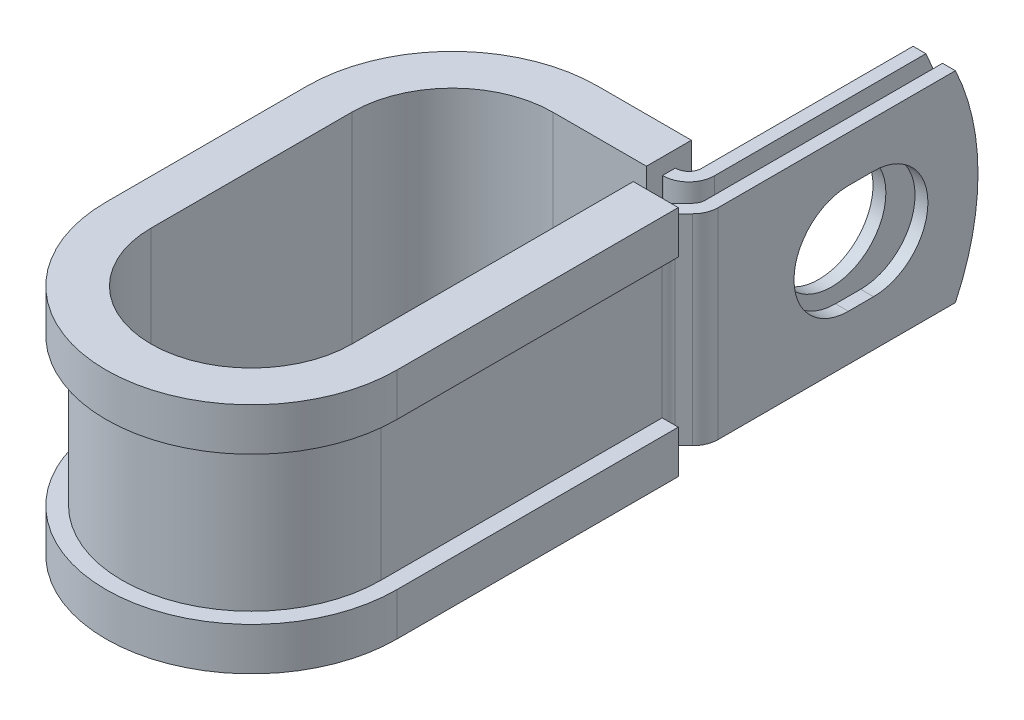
SolidWorks part; units mm, degrees
ref_plane "Front Plane" through (0, 0, 0) normal (0, 0, 1) x (1, 0, 0)
ref_plane "Top Plane" through (0, 0, 0) normal (0, 1, 0) x (1, 0, 0)
ref_plane "Right Plane" through (0, 0, 0) normal (1, 0, 0) x (0, 0, -1)
sketch "Sketch1" plane through (0, 0, 0) normal (0, 1, 0) x (1, 0, 0)
  line L0 (0, 11.049) -> (8.9333, 11.049)
  line L1 (11.049, 0) -> (11.049, 7.6365)
  line L2 (11.3717, 35.687) -> (11.3717, 13.4874)
  line L3 (11.7632, 9.3607) -> (12.5894, 10.1869)
  line L4 (-11.049, 0) -> (-11.049, -19.05)
  line L5 (12.9465, 11.049) -> (12.9465, 35.687)
  line L6 (11.049, 0) -> (11.049, -19.05)
  arc A0 (0, 11.049) -> (-11.049, 0) centre (0, 0) ccw
  arc A1 (11.7632, 9.3607) -> (11.049, 7.6365) centre (13.4874, 7.6365) ccw
  arc A2 (12.5894, 10.1869) -> (12.9465, 11.049) centre (11.7273, 11.049) ccw
  arc A3 (8.9333, 11.049) -> (11.3717, 13.4874) centre (8.9333, 13.4874) ccw
  arc A4 (-11.049, -19.05) -> (11.049, -19.05) centre (0, -19.05) ccw
extrude "Extrude-Thin1" add sketch "Sketch1" along normal mid plane 19.05 thin
sketch "Sketch2" plane through (10.1525, 0, 0) normal (-1, 0, 0) x (0, 0, 1)
  line L0 (-35.687, 9.525) -> (-35.687, -9.525) construction
  line L1 (0, 9.525) -> (0, -9.525) construction
  circle A0 centre (-24.5872, 0) radius 5.1562
  point P2 (-35.687, 0)
extrude "Cut-Extrude1" cut sketch "Sketch2" against normal up to surface (1.2192 mm away)
sketch "Sketch3" plane through (14.1657, 0, 0) normal (1, 0, 0) x (0, 0, -1)
  line L0 (23.3934, 0) -> (25.781, 0) construction
  line L1 (23.3934, 5.1562) -> (25.781, 5.1562)
  line L2 (23.3934, -5.1562) -> (25.781, -5.1562)
  line L3 (35.687, 9.525) -> (35.687, -9.525) construction
  arc A0 (23.3934, 5.1562) -> (23.3934, -5.1562) centre (23.3934, 0) ccw
  arc A1 (25.781, -5.1562) -> (25.781, 5.1562) centre (25.781, 0) ccw
  point P3 (24.5872, 0)
  point P8 (35.687, 0)
  point P11 (18.2372, 0)
  point P12 (30.9372, 0)
extrude "Cut-Extrude2" cut sketch "Sketch3" against normal up to surface (1.2192 mm away)
sketch "Sketch4" plane through (10.1525, 0, 0) normal (-1, 0, 0) x (0, 0, 1)
  line L0 (-35.687, 9.525) -> (-35.687, -9.525)
  line L1 (-35.687, 9.525) -> (-33.5425, 9.525)
  line L2 (-35.687, 9.525) -> (-13.4874, 9.525) construction
  line L3 (-35.687, -9.525) -> (-33.5425, -9.525)
  line L4 (-35.687, -9.525) -> (-13.4874, -9.525) construction
  arc A0 (-33.5425, 9.525) -> (-33.5425, -9.525) centre (-13.462, 0) ccw
extrude "Cut-Extrude3" cut sketch "Sketch4" against normal through all contours A0 M4 M5 | A0 L0 M2
ref_plane "Plane1" through (0, 0, -7.6365) normal (0, 0, -1) x (-1, 0, 0)
ref_plane "Plane2" through (8.8825, 0, 0) normal (-1, 0, 0) x (0, 0, 1)
sketch "Sketch5" plane through (0, 0, -7.6365) normal (0, 0, -1) x (-1, 0, 0)
  line L0 (-12.2682, 9.525) -> (-11.049, 9.525)
  line L1 (-12.2682, 9.525) -> (-12.2682, -9.525) construction
  line L3 (-11.049, 9.525) -> (-11.049, -9.525)
  line L4 (-11.049, -9.525) -> (-12.2682, -9.525)
  line L5 (-12.2682, -9.525) -> (-12.2682, -6.985)
  line L6 (-12.2682, 9.525) -> (-12.2682, 6.985)
  line L7 (-13.7922, 11.049) -> (-13.7922, 6.985)
  line L8 (-13.7922, 11.049) -> (-9.525, 11.049)
  line L9 (-9.525, 11.049) -> (-9.525, -11.049)
  line L10 (-9.525, -11.049) -> (-13.7922, -11.049)
  line L11 (-13.7922, -11.049) -> (-13.7922, -6.985)
  line L12 (-13.7922, 6.985) -> (-12.2682, 6.985)
  line L13 (-12.2682, -6.985) -> (-13.7922, -6.985)
sketch "Sketch6" plane through (0, 9.525, 0) normal (0, 1, 0) x (1, 0, 0)
  line L0 (9.525, 0) -> (9.525, 7.6365)
  line L1 (9.525, 7.6365) -> (13.7922, 7.6365) construction
  line L2 (8.8825, 6.9878) -> (8.8825, -6.9878) construction
  line L3 (9.525, -19.05) -> (9.525, 0)
  line L4 (-9.525, -19.05) -> (-9.525, 0)
  line L5 (0, 9.525) -> (8.8825, 9.525)
  arc A0 (0, 9.525) -> (-9.525, 0) centre (0, 0) ccw
  arc A1 (-9.525, -19.05) -> (9.525, -19.05) centre (0, -19.05) ccw
sweep "Sweep1" add profiles "Sketch5" path "Sketch6"
equation "\"D4@Sketch5\" = \"D1@Extrude-Thin1\""
equation "\"D5@Sketch5\" = \"D5@Extrude-Thin1\""
equation "\"D1@Sketch3\" = \"D2@Sketch2\""
equation "\"D7@Sketch1\" = \"D3@Sketch2\" + \"D1@Sketch3\""
equation "\"D1@Sketch1\" = \"D1@Sketch6\" + 2 * \"D3@Sketch5\""
equation "\"D1@Sketch4\" = ( \"D1@Extrude-Thin1\" + .125 ) * 2"
equation "\"D9@Sketch1\"= \"D5@Extrude-Thin1\""
equation "\"D8@Sketch1\"= 2 * \"D5@Extrude-Thin1\""
equation "\"D2@Sketch1\" = 2 * \"D5@Extrude-Thin1\""
equation "\"D2@Sketch3\" = \"D1@Sketch2\""
equation "\"D6@Sketch1\" = \"D1@Sketch1\""
equation "\"D3@Sketch1\" = \"D1@Sketch6\""
